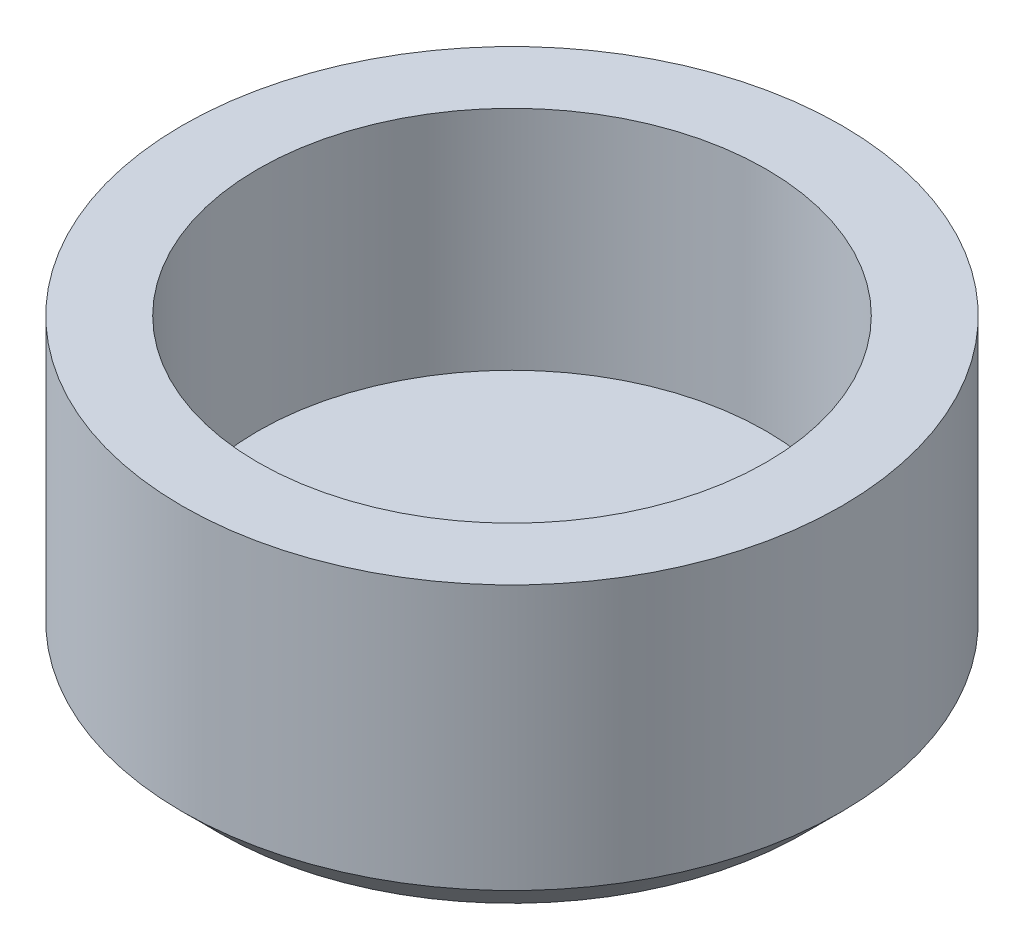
SolidWorks part; units mm, degrees
ref_plane "Front Plane" through (0, 0, 0) normal (0, 0, 1) x (1, 0, 0)
ref_plane "Top Plane" through (0, 0, 0) normal (0, 1, 0) x (1, 0, 0)
ref_plane "Right Plane" through (0, 0, 0) normal (1, 0, 0) x (0, 0, -1)
sketch "Sketch2" plane through (0, 0, 0) normal (0, 0, 1) x (1, 0, 0)
  line L0 (0, 0) -> (0, -3.175)
  line L1 (0, -3.175) -> (13.843, -3.175)
  line L2 (13.843, -3.175) -> (13.843, 9.525)
  line L3 (13.843, 9.525) -> (10.668, 9.525)
  line L4 (10.668, 9.525) -> (10.668, 0)
  line L5 (10.668, 0) -> (0, 0)
  line L6 (0, 0) -> (0, 51.3663) construction
  dimension "D1" = 21.336
  dimension "D2" = 3.175
  dimension "D3" = 12.7
  dimension "D4" = 3.175
revolve "Revolve1" add sketch "Sketch2" angle 360 about L6
chamfer "Chamfer1" distance 1.5875 angle 45 1 edges at (0, -3.175, -13.843)
